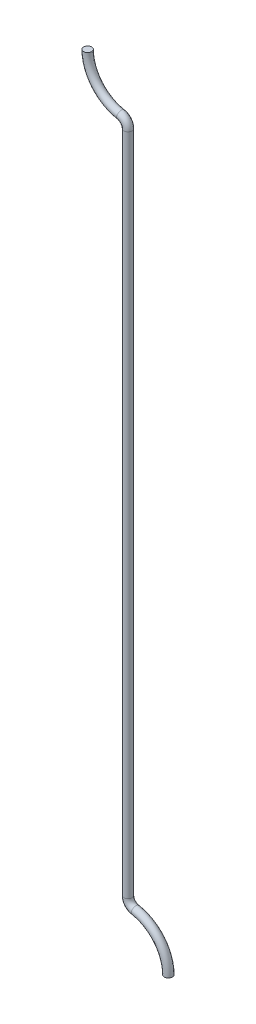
SolidWorks part; units mm, degrees
ref_plane "Plan de face" through (0, 0, 0) normal (0, 0, 1) x (1, 0, 0)
ref_plane "Plan de dessus" through (0, 0, 0) normal (0, 1, 0) x (1, 0, 0)
ref_plane "Plan de droite" through (0, 0, 0) normal (1, 0, 0) x (0, 0, -1)
sketch "Esquisse1" plane through (0, 0, 0) normal (0, 0, 1) x (1, 0, 0)
  line L0 (-0.1176, -74.0383) -> (-0.1176, 0)
  line L1 (-0.1176, 0) -> (-0.1176, 74.0383)
  arc A0 (-9.1176, 84.855) -> (-1.754, 76.005) centre (-0.1176, 84.855) ccw
  arc A1 (8.8824, -84.855) -> (1.5188, -76.005) centre (-0.1176, -84.855) ccw
  arc A2 (-0.1176, -74.0383) -> (1.5188, -76.005) centre (1.8824, -74.0383) ccw
  arc A3 (-0.1176, 74.0383) -> (-1.754, 76.005) centre (-2.1176, 74.0383) ccw
ref_plane "Plan1" through (0, 84.855, 0) normal (0, 1, 0) x (-1, 0, 0)
sketch "Esquisse3" plane through (0, 84.855, 0) normal (0, 1, 0) x (-1, 0, 0)
  line L0 (9.1176, 0) -> (1.754, 0) construction
  circle A0 centre (9.1176, 0) radius 0.9
sweep "Balayage2" add profiles "Esquisse3" path "Esquisse1"
sketch "Esquisse4" plane through (0, 0, 0) normal (1, 0, 0) x (0, 0, -1)
  line L0 (-29.6818, 0) -> (38.5144, 0)
